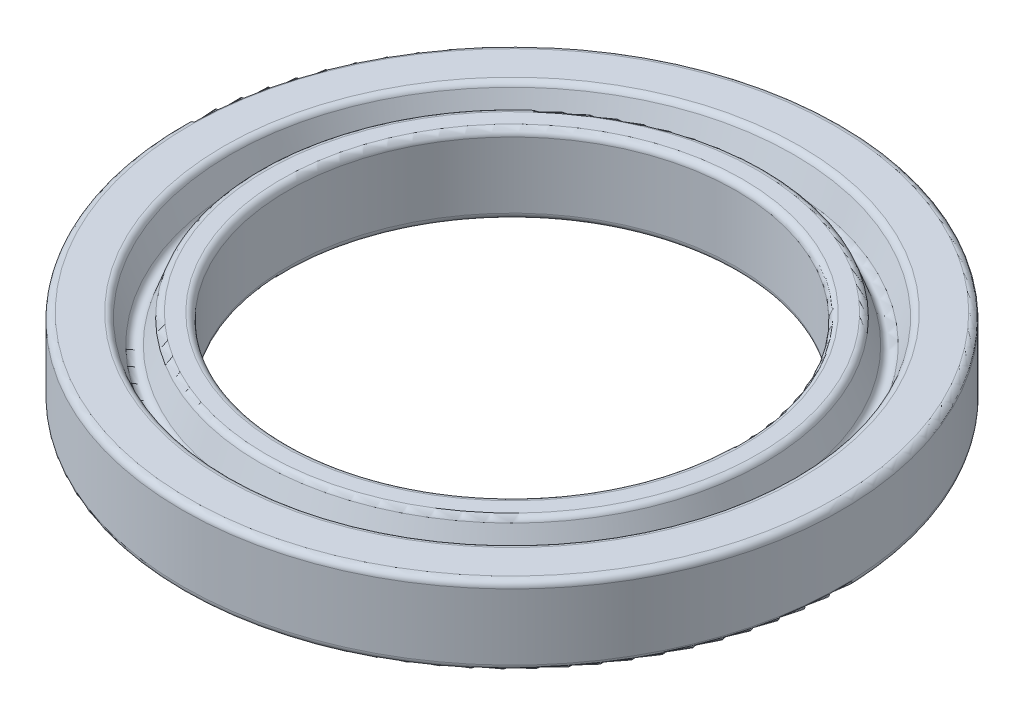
SolidWorks part; units mm, degrees
ref_plane "Plan1" through (0, 0, 0) normal (0, 0, 1) x (1, 0, 0)
ref_plane "Plan2" through (0, 0, 0) normal (0, 1, 0) x (1, 0, 0)
ref_plane "Plan3" through (0, 0, 0) normal (1, 0, 0) x (0, 0, -1)
sketch "Esquisse1" plane through (0, 0, 0) normal (0, 0, 1) x (1, 0, 0)
  line L0 (0, 40) -> (0, -40) construction
  line L1 (9.5, 2.5) -> (10.125, 0.7828)
  line L2 (8.5, -0.5) -> (10.5, -0.5)
  line L3 (8.5, -0.5) -> (8.5, 2.5)
  line L4 (8.5, 2.5) -> (9.5, 2.5)
  line L5 (12.5, -0.5) -> (12.5, 2.5)
  line L6 (10.75, 2.5) -> (10.125, 0.7828)
  line L7 (10.75, 2.5) -> (12.5, 2.5)
  line L8 (11.5, -0.5) -> (11.0071, 0.8544)
  line L9 (10.5, -0.5) -> (11.0071, 0.8544)
  line L10 (11.5, -0.5) -> (12.5, -0.5)
  dimension "D1" = 8.5
  dimension "D2" = 12.5
  dimension "D3" = 3
  dimension "D4" = 1
  dimension "D5" = 110
  dimension "D6" = 110
  dimension "D7" = 1.75
  dimension "D8" = 1
  dimension "D9" = 110
revolve "Base-Révolution" add sketch "Esquisse1" angle 360 about L0
fillet "Congé1" radius 0.25
